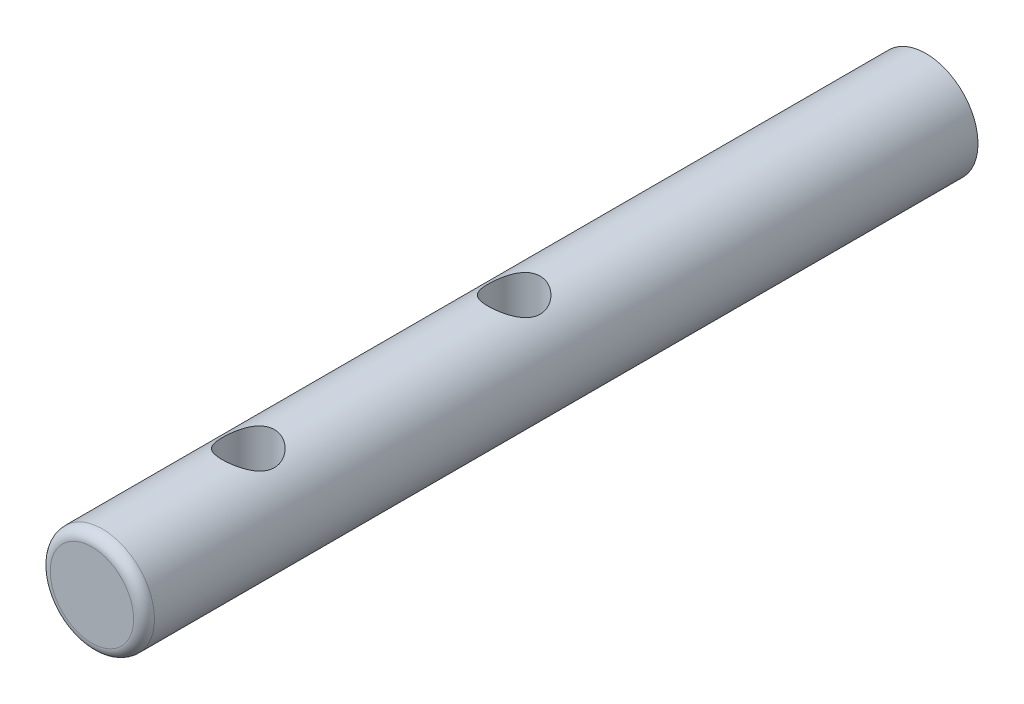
SolidWorks part; units mm, degrees
ref_plane "Front Plane" through (0, 0, 0) normal (0, 0, 1) x (1, 0, 0)
ref_plane "Top Plane" through (0, 0, 0) normal (0, 1, 0) x (1, 0, 0)
ref_plane "Right Plane" through (0, 0, 0) normal (1, 0, 0) x (0, 0, -1)
sketch "Sketch1" plane through (0, 0, 0) normal (0, 0, 1) x (1, 0, 0)
  circle A0 centre (0, 0) radius 6.35
  dimension "D1" = 12.7
extrude "Boss-Extrude1" add sketch "Sketch1" along normal blind 101.6
sketch "Sketch2" plane through (0, 0, 0) normal (0, 0, -1) x (-1, 0, 0)
  point P0 (0, 0)
hole_wizard "M5 Tapped Hole1" positions "Sketch3" profile "Sketch4" tap size "M5" standard "AS"
sketch "Sketch3" plane through (0, 0, 0) normal (0, 0, -1) x (-1, 0, 0)
  point P0 (0, 0)
sketch "Sketch4" plane through (0, 0, 0) normal (1, 0, 0) x (0, 1, 0)
  line L0 (0, 0) -> (0, 26.6618)
  line L1 (0, 26.6618) -> (2.1, 25.4)
  line L2 (2.1, 25.4) -> (2.1, 0)
  line L5 (2.1, 0) -> (0, 0)
  line L10 (0, 26.6618) -> (-2.1, 25.4) construction
  line L11 (0, -6.35) -> (0, 107.95) construction
  dimension "Tap Drill Dia." = 4.2
  dimension "Tap Drill Depth" = 25.4
  dimension "Drill Angle" = 118
fillet "Fillet1" radius 1.27 1 edges at (6.35, 0, 101.6)
ref_plane "Plane1" through (0, -6.35, 0) normal (0, -1, 0) x (-1, 0, 0)
sketch "Sketch5" plane through (0, -6.35, 0) normal (0, -1, 0) x (-1, 0, 0)
  line L0 (0, 0) -> (0, -101.6) construction
  line L1 (-5.08, -101.6) -> (5.08, -101.6) construction
  point P5 (0, -88.9)
  point P6 (0, -57.15)
  dimension "D1" = 12.7
  dimension "D2" = 44.45
sketch "Sketch8" plane through (0, -6.35, 0) normal (0, -1, 0) x (-1, 0, 0)
  line L0 (8.255, -88.9) -> (-8.255, -88.9) construction
  line L1 (8.255, -88.9) -> (-8.255, -88.9)
  line L2 (-5.08, -101.6) -> (5.08, -101.6) construction
  circle A1 centre (0, -50.165) radius 3.175 construction
  circle A2 centre (0, -50.165) radius 3.175
  circle A3 centre (0, -82.55) radius 3.175
  point P4 (0, -83.7361)
  point P10 (0, -82.1787)
  dimension "D1" = 6.35
  dimension "D2" = 12.7
  dimension "D3" = 6.35
extrude "Cut-Extrude1" cut sketch "Sketch8" against normal through all contours A2 | A3
